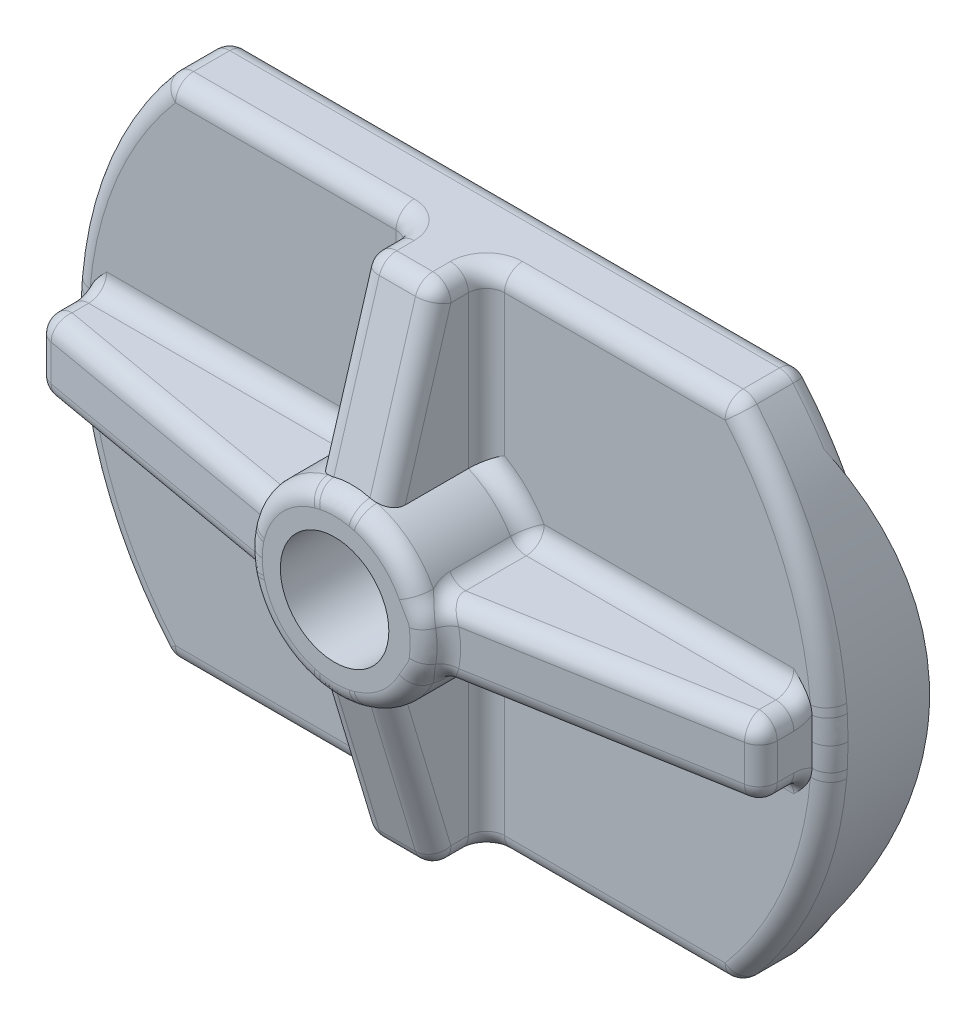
SolidWorks part; units mm, degrees
ref_plane "Plan1" through (0, 0, 0) normal (0, 0, 1) x (1, 0, 0)
ref_plane "Plan2" through (0, 0, 0) normal (0, 1, 0) x (1, 0, 0)
ref_plane "Plan3" through (0, 0, 0) normal (1, 0, 0) x (0, 0, -1)
sketch "Esquisse1" plane through (0, 0, 0) normal (0, 0, 1) x (1, 0, 0)
  line L0 (-23.6605, 0) -> (24.072, 0) construction
  line L1 (0, 18.9284) -> (0, -17.2825) construction
  line L2 (-15.6525, 14) -> (15.6525, 14)
  line L3 (-15.6525, -14) -> (15.6525, -14)
  arc A0 (15.6525, -14) -> (15.6525, 14) centre (0, 0) ccw
  arc A1 (-15.6525, 14) -> (-15.6525, -14) centre (0, 0) ccw
  dimension "D1" = 42
  dimension "D2" = 28
extrude "Base-Extrusion" add sketch "Esquisse1" along normal blind 5.5
sketch "Esquisse2" plane through (0, 0, 5.5) normal (0, 0, 1) x (1, 0, 0)
  circle A0 centre (0, 0) radius 5
  dimension "D1" = 10
extrude "Boss.-Extru.1" add sketch "Esquisse2" along normal blind 6.4
sketch "Esquisse3" plane through (0, 0, 11.9) normal (0, 0, 1) x (1, 0, 0)
  circle A0 centre (0, 0) radius 3
  dimension "D1" = 6
extrude "Enlèv. mat.-Extru.1" cut sketch "Esquisse3" against normal blind 7
sketch "Esquisse4" plane through (0, 0, 0) normal (0, 1, 0) x (1, 0, 0)
  line L0 (0, 2.0912) -> (0, -14.06) construction
  line L1 (0, -5.5) -> (0, 0) construction
  line L2 (5, -10.9) -> (19.1736, -8.4008)
  line L3 (5, -11.9) -> (5, -5.5) construction
  line L5 (20, -7.416) -> (20, -5.5)
  line L6 (-5, -11.9) -> (5, -11.9) construction
  arc A0 (20, -7.416) -> (19.1736, -8.4008) centre (19, -7.416) cw
  point P16 (20, -8.2551)
  dimension "D4" = 1
  dimension "D1" = 20
  dimension "D2" = 80
  dimension "D3" = 1
rib "Nervure5" sketch "Esquisse4" sketch "Esquisse4" thickness 4 extrusion direction parallel to sketch draft on no parameters "D1"=4
mirror "Symétrie1" about plane through (0, 0, 0) normal (1, 0, 0) of "Nervure5"
sketch "Esquisse5" plane through (0, 0, 0) normal (1, 0, 0) x (0, 0, -1)
  line L0 (-10.9, 5.0401) -> (-8.4257, 13.2874)
  line L1 (-5.5, 14) -> (-7.4679, 14)
  line L2 (-11.9, 5) -> (-11.9, -5) construction
  arc A0 (-8.4257, 13.2874) -> (-7.4679, 14) centre (-7.4679, 13) cw
  dimension "D3" = 1
  dimension "D1" = 1
  dimension "D2" = 73.3
rib "Nervure7" sketch "Esquisse5" sketch "Esquisse5" thickness 4 extrusion direction parallel to sketch draft on no parameters "D1"=4
mirror "Symétrie2" about plane through (0, 0, 0) normal (0, 1, 0) of "Nervure7"
sketch "Esquisse6" plane through (0, 14, 0) normal (0, 1, 0) x (-1, 0, 0)
  line L0 (0, -3.1909) -> (0, 6.1909) construction
  line L1 (0, 5.5) -> (0, 0) construction
  line L2 (19, 1.5) -> (-19, 1.5)
  line L3 (-19, 1.5) -> (-21, -0.0071)
  line L4 (-21, 5.5) -> (-21, 0) construction
  line L5 (19, 1.5) -> (21, -0.0071)
  line L6 (21, -0.0071) -> (21, -1.7476)
  line L7 (-21, -0.0071) -> (-21, -1.7476)
  line L8 (21, -1.7476) -> (-21, -1.7476)
  line L9 (15.6525, 0) -> (21, 0) construction
  point P7 (0, 1.5)
  point P14 (0, -1.7476)
  dimension "D1" = 19
  dimension "D2" = 143
  dimension "D3" = 1.5
extrude "Enlèv. mat.-Extru.2" cut sketch "Esquisse6" against normal through all
fillet "Congé1" radius 1 12 edges at (2, -9.2913, 5.5) (3.5355, -3.5355, 5.5) (12.2913, -2, 5.5) (-12.2913, -2, 5.5) (-3.5355, -3.5355, 5.5) (-2, -9.2913, 5.5) (-12.2913, 2, 5.5) (-3.5355, 3.5355, 5.5) (-2, 9.2913, 5.5) (2, 9.2913, 5.5) (3.5355, 3.5355, 5.5) (12.2913, 2, 5.5)
fillet "Congé2" radius 1 41 edges at (-9.3262, -14, 5.5) (-2.2929, -14, 5.7929) (-2, -14, 6.9839) (-2, -13.8023, 8.0648) (-2, -8.935, 9.7315) (4.6897, 2.1655, 5.949) (4.5826, 2, 8.7368) (5, 0, 10.9) (20, -2.2929, 5.7929) (4.6897, -2.1655, 5.949) (20, 2.2929, 5.7929) (20, 2, 6.958) (19.766, 2, 8.0588) (-20, -2.2929, 5.7929) (-20, -2, 6.958) (-19.766, -2, 8.0588) (-20, 2.2929, 5.7929) (-20, 2, 6.958) (-19.766, 2, 8.0588) (-9.3262, 14, 5.5) (-2.2929, 14, 5.7929) (-2, 14, 6.9839) (-2, 13.8023, 8.0648) (9.3262, 14, 5.5) (2.2929, 14, 5.7929) (2, 14, 6.9839) (2, 13.8023, 8.0648) (9.3262, -14, 5.5) (2.2929, -14, 5.7929) (2, -14, 6.9839) (2, -13.8023, 8.0648) (11.8781, -2, 9.6872) (19.766, -2, 8.0588) (20, -2, 6.958) (4.5826, -2, 8.7368) (11.8781, 2, 9.6872) (-11.8781, -2, 9.6872) (-11.8781, 2, 9.6872) (-2, 8.935, 9.7315) (2, 8.935, 9.7315) (2, -8.935, 9.7315)
fillet "Congé3" radius 1 10 edges at (-15.6525, 14, 3) (-15.8707, 13.7521, 5.159) (-15.6525, -14, 3) (-15.7765, -13.8601, 5.0102) (15.6525, -14, 3) (15.8707, -13.7521, 5.159) (15.6525, 14, 3) (15.7765, 13.8601, 5.0102) (-21, 0, 5.5) (21, 0, 5.5)
fillet "Congé4" radius 1 11 edges at (-17.637, 11.399, 1.5) (-15.617, 13.9083, 1.5) (17.637, 11.399, 1.5) (15.617, 13.9083, 1.5) (-17.637, -11.399, 1.5) (-15.617, -13.9083, 1.5) (17.637, -11.399, 1.5) (15.617, -13.9083, 1.5) (0, 14, 1.5) (0, -14, 1.5) (5, 0, 11.9)
